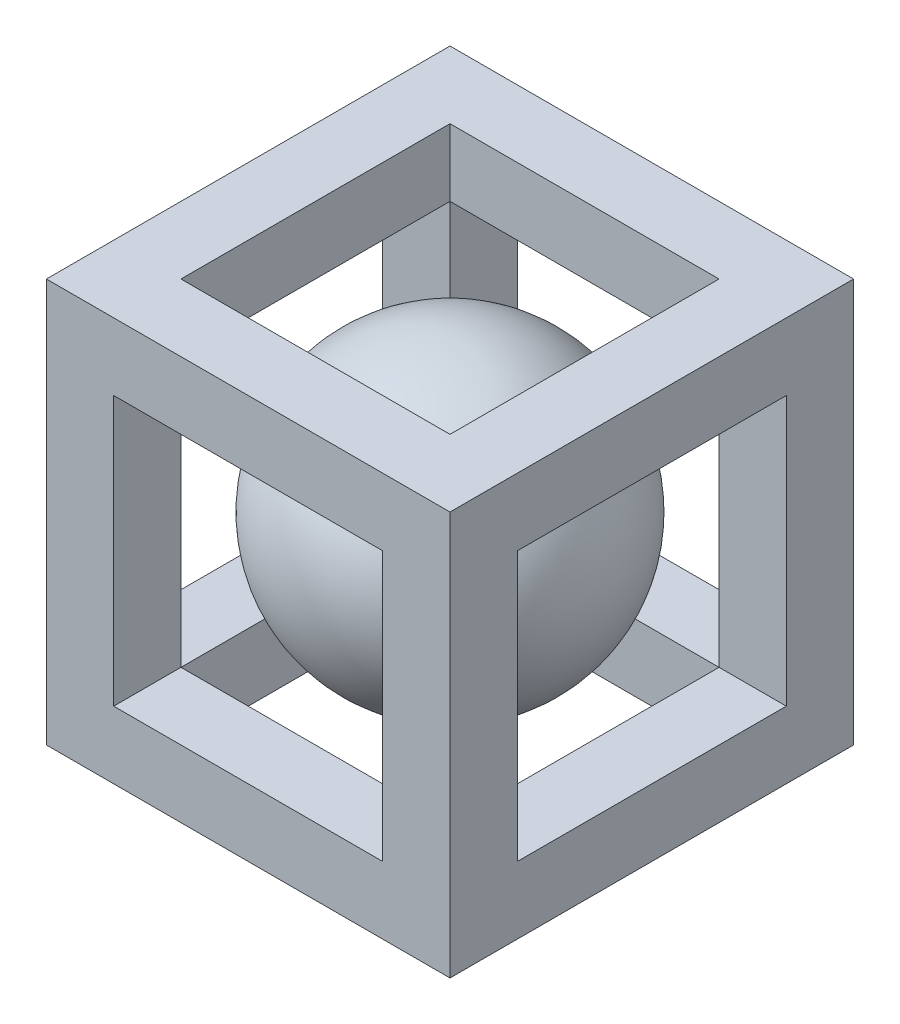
SolidWorks part; units mm, degrees
ref_plane "Alzado" through (0, 0, 0) normal (0, 0, 1) x (1, 0, 0)
ref_plane "Planta" through (0, 0, 0) normal (0, 1, 0) x (1, 0, 0)
ref_plane "Vista lateral" through (0, 0, 0) normal (1, 0, 0) x (0, 0, -1)
sketch "Croquis1" plane through (0, 0, 0) normal (0, 0, 1) x (1, 0, 0)
  line L1 (0, 0) -> (-60, 0)
  line L2 (0, 0) -> (0, 60)
  line L3 (0, 60) -> (-60, 60)
  line L4 (-60, 0) -> (-60, 60)
  line L5 (-10, 10) -> (-50, 10)
  line L6 (-10, 10) -> (-10, 50)
  line L7 (-10, 50) -> (-50, 50)
  line L8 (-50, 10) -> (-50, 50)
  point P9 (-30, 0)
  dimension "D1" = 60
  dimension "D2" = 60
  dimension "D3" = 10
  dimension "D4" = 10
  dimension "D5" = 10
  dimension "D6" = 10
extrude "Saliente-Extruir1" add sketch "Croquis1" along normal blind 60
sketch "Croquis2" plane through (0, 60, 0) normal (0, 1, 0) x (1, 0, 0)
  line L0 (-33, 0) -> (33, 0) construction
  line L1 (-10, -50) -> (-50, -50)
  line L2 (-10, -50) -> (-10, -10)
  line L3 (-10, -10) -> (-50, -10)
  line L4 (-50, -50) -> (-50, -10)
  line L5 (-60, -60) -> (-60, 0) construction
  line L6 (0, -60) -> (-60, -60) construction
  line L7 (0, -33) -> (0, 33) construction
  dimension "D1" = 10
  dimension "D2" = 10
  dimension "D3" = 10
  dimension "D4" = 10
extrude "Cortar-Extruir1" cut sketch "Croquis2" against normal through all
ref_plane "Plano1" through (-30, 0, 0) normal (1, 0, 0) x (0, 0, -1)
sketch "Croquis3" plane through (-30, 0, 0) normal (1, 0, 0) x (0, 0, -1)
  line L0 (-60, 60) -> (0, 60) construction
  line L1 (-50, 50) -> (-10, 50)
  line L2 (-50, 50) -> (-50, 10)
  line L3 (-50, 10) -> (-10, 10)
  line L4 (-10, 50) -> (-10, 10)
  line L5 (33, 0) -> (-33, 0) construction
  line L6 (0, 33) -> (0, -33) construction
  line L7 (-60, 0) -> (-60, 60) construction
  dimension "D1" = 10
  dimension "D2" = 10
  dimension "D3" = 10
  dimension "D4" = 10
extrude "Cortar-Extruir2" cut sketch "Croquis3" against normal through all and the other way blind 60
sketch "Croquis4" plane through (-30, 0, 0) normal (1, 0, 0) x (0, 0, -1)
  line L0 (-30, 50) -> (-30, 10) construction
  line L1 (-50, 10) -> (-10, 10) construction
  line L2 (-10, 50) -> (-50, 50) construction
  line L3 (-30, 52.5) -> (-30, 7.5)
  line L4 (-50, 30) -> (-23.8825, 30) construction
  line L5 (-50, 50) -> (-50, 10) construction
  arc A0 (-30, 7.5) -> (-30, 52.5) centre (-30, 30) ccw
  point P11 (0, 0)
  point P14 (0, 0)
  point P15 (-23.8825, 30.265)
  point P16 (0, 0)
  dimension "D1" = 45
revolve "Revolución1" add sketch "Croquis4" angle 360 about L0
